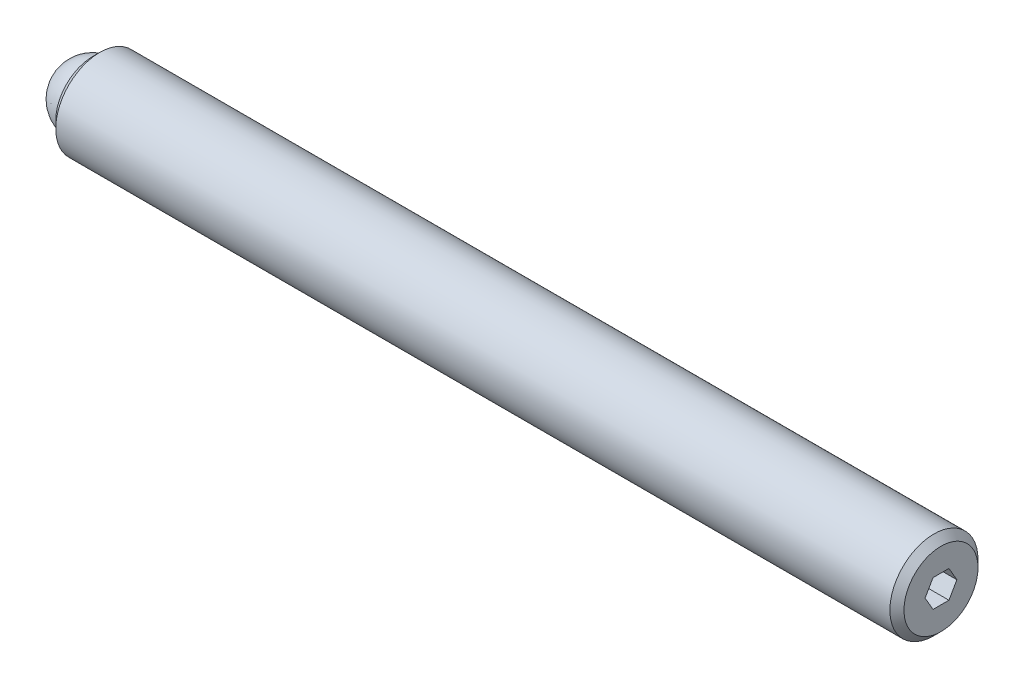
SolidWorks part; units mm, degrees
ref_plane "Front Plane" through (0, 0, 0) normal (0, 0, 1) x (1, 0, 0)
ref_plane "Top Plane" through (0, 0, 0) normal (0, 1, 0) x (1, 0, 0)
ref_plane "Right Plane" through (0, 0, 0) normal (1, 0, 0) x (0, 0, -1)
sketch "Sketch2" plane through (0, 0, 0) normal (1, 0, 0) x (0, 0, -1)
  circle A0 centre (0, 0) radius 3.175
  dimension "D1" = 6.35
extrude "Boss-Extrude1" add sketch "Sketch2" along normal blind 61.1187
sketch "Sketch3" plane through (0, 0, 0) normal (-1, 0, 0) x (0, 0, 1)
  circle A0 centre (0, 0) radius 2.3813
  dimension "D1" = 4.7625
chamfer "Chamfer1" distance 0.508 angle 45 1 edges at (0, 0, -3.175)
chamfer "Chamfer2" distance 0.508 angle 45 1 edges at (61.1187, 0, -3.175)
sketch "Sketch4" plane through (61.1187, 0, 0) normal (1, 0, 0) x (0, 0, -1)
  line L1 (1.1457, 0) -> (0.5728, 0.9922)
  line L2 (0.5728, 0.9922) -> (-0.5728, 0.9922)
  line L3 (-0.5728, 0.9922) -> (-1.1457, 0)
  line L4 (-1.1457, 0) -> (-0.5728, -0.9922)
  line L5 (-0.5728, -0.9922) -> (0.5728, -0.9922)
  line L6 (0.5728, -0.9922) -> (1.1457, 0)
  circle A0 centre (0, 0) radius 0.9922 construction
  dimension "D1" = 1.9844
extrude "Cut-Extrude2" cut sketch "Sketch4" against normal blind 2.286
extrude "Cut-Extrude3" cut sketch "Sketch3" against normal blind 1.9844
sketch "Sketch5" plane through (0, 0, 0) normal (-1, 0, 0) x (0, 0, 1)
  line L0 (0, 0) -> (0, -2.3813)
  line L1 (0, 0) -> (0, 2.3813)
  arc A0 (0, 2.3813) -> (0, -2.3813) centre (0, 0) ccw
  dimension "D1" = 2.3813
revolve "Revolve1" add sketch "Sketch5" angle 360 about L1
